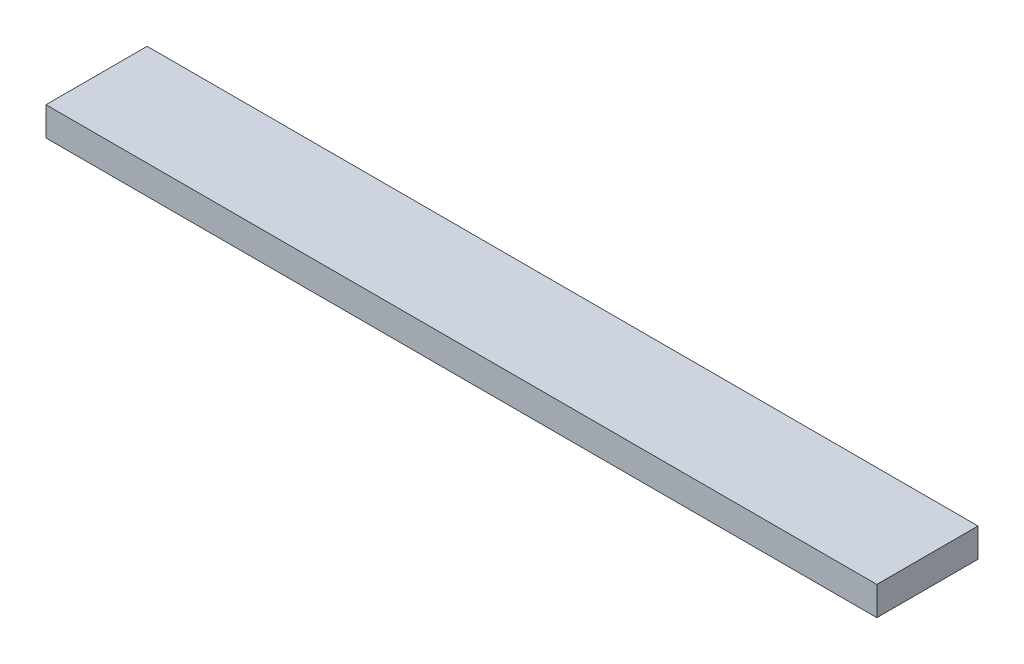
SolidWorks part; units mm, degrees
ref_plane "Ebene vorne" through (0, 0, 0) normal (0, 0, 1) x (1, 0, 0)
ref_plane "Ebene oben" through (0, 0, 0) normal (0, 1, 0) x (1, 0, 0)
ref_plane "Ebene rechts" through (0, 0, 0) normal (1, 0, 0) x (0, 0, -1)
sketch "Skizze1" plane through (0, 0, 0) normal (0, 0, 1) x (1, 0, 0)
  line L1 (0, 0) -> (821.261, 0)
  line L2 (0, 0) -> (0, 28.516)
  line L3 (0, 28.516) -> (821.261, 28.516)
  line L4 (821.261, 0) -> (821.261, 28.516)
extrude "Linear austragen1" add sketch "Skizze1" along normal blind 100
sketch "Skizze2" plane through (0, 0, 100) normal (0, 0, 1) x (1, 0, 0)
  line L0 (410.6305, 28.516) -> (410.6305, 82.4233) construction
  line L1 (821.261, 28.516) -> (0, 28.516) construction
ref_plane "Ebene1" through (410.6305, 0, 0) normal (1, 0, 0) x (0, 0, -1)
equation "\"LÄNGE\"=0"
equation "\"BREITE\"=0"
equation "\"HÖHE\"=0"
equation "\"DURCHMESSER\"=0"
equation "\"Stückzahl\"= 1"
